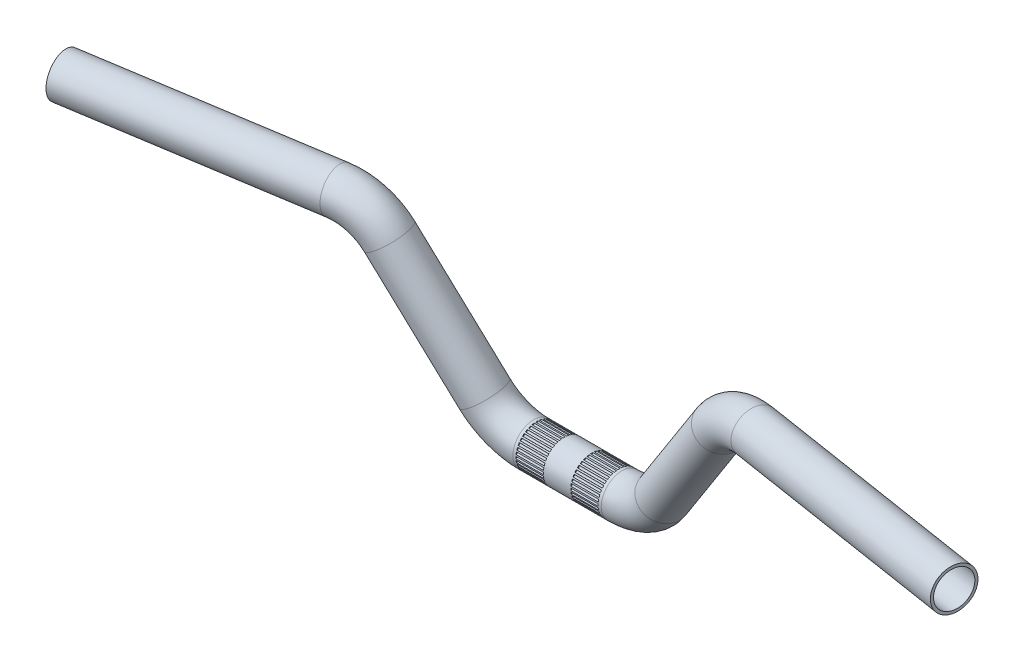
SolidWorks part; units mm, degrees
ref_plane "Front Plane" through (0, 0, 0) normal (0, 0, 1) x (1, 0, 0)
ref_plane "Top Plane" through (0, 0, 0) normal (0, 1, 0) x (1, 0, 0)
ref_plane "Right Plane" through (0, 0, 0) normal (1, 0, 0) x (0, 0, -1)
ref_plane "Plane1" through (0, 0, 25) normal (0, 0, 1) x (1, 0, 0)
ref_plane "Plane2" through (0, 0, 63) normal (0, 0, 1) x (1, 0, 0)
sketch "Sketch1" plane through (0, 0, 25) normal (0, 0, 1) x (1, 0, 0)
  point P0 (165, 140)
  dimension "D1" = 165
  dimension "140" = 140
sketch "Sketch2" plane through (0, 0, 63) normal (0, 0, 1) x (1, 0, 0)
  point P0 (406, 140)
  dimension "D1" = 406
  dimension "140" = 140
sketch3d "3DSketch1"
  line L0 (0, 0, 0) -> (40.2572, 0, 0)
  line L1 (81.3527, 21.184, 3.7828) -> (150.4303, 119.3046, 21.3044)
  line L2 (190.2658, 140, 28.9838) -> (406, 140, 63)
  arc A0 (190.2658, 140, 28.9838) -> (150.4303, 119.3046, 21.3044) centre (190.7844, 90.111, 25.6948) ccw
  arc A1 (81.3527, 21.184, 3.7828) -> (40.2572, 0, 0) centre (40.2572, 49.2214, 8.7895) ccw
  point P9 (165, 140, 25)
  point P10 (183.0141, 86.7813, 74.975)
  point P13 (66.439, 0, 0)
  point P14 (40.2572, 58.0109, -40.4318)
  dimension "D1" = 50
sketch "Sketch5" plane through (0, 0, 0) normal (1, 0, 0) x (0, 0, -1)
  circle A0 centre (0, 0) radius 19
  dimension "D1" = 38
sweep "Sweep-Thin1" add profiles "Sketch5" path "3DSketch1" parameters "D1"=2.5
mirror "Mirror1" about plane through (0, 0, 0) normal (1, 0, 0) of "Sweep-Thin1"
sketch "Sketch6" plane through (0, 0, 0) normal (1, 0, 0) x (0, 0, -1)
  circle A0 centre (0, -19) radius 1
  dimension "D1" = 19
  dimension "D2" = 2
extrude "Cut-Extrude1" cut sketch "Sketch6" against normal blind 25 from offset 12.5
pattern_circular "CirPattern1" count 36 over 360 about axis through (0, 0, 0) along (1, 0, 0) of "Cut-Extrude1"
mirror "Mirror2" about plane through (0, 0, 0) normal (1, 0, 0) of "CirPattern1", "Cut-Extrude1"
